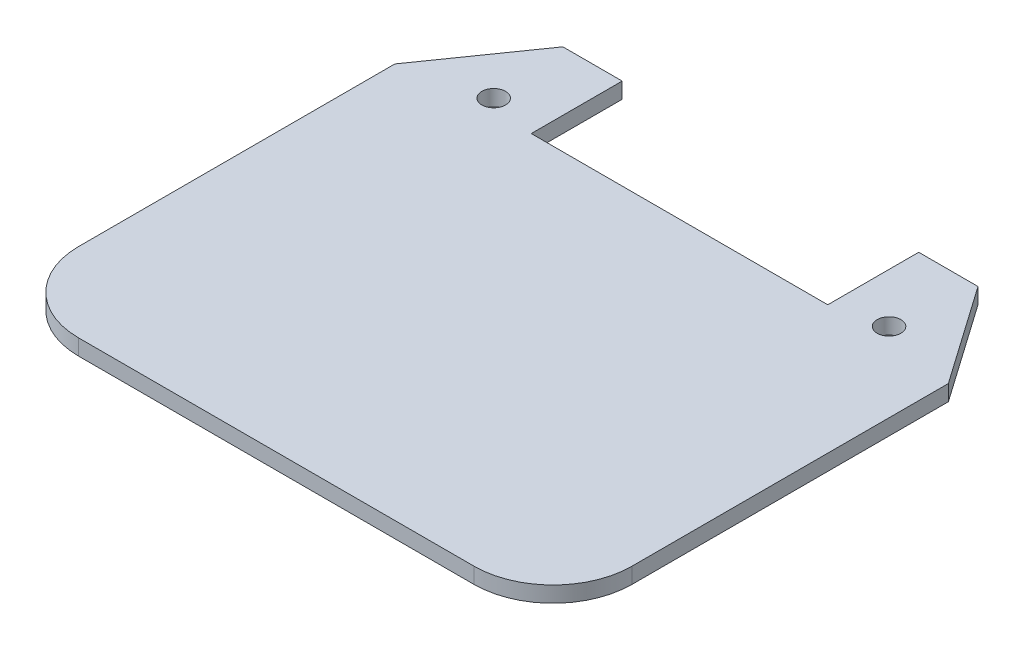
SolidWorks part; units mm, degrees
ref_plane "前视基准面" through (0, 0, 0) normal (0, 0, 1) x (1, 0, 0)
ref_plane "上视基准面" through (0, 0, 0) normal (0, 1, 0) x (1, 0, 0)
ref_plane "右视基准面" through (0, 0, 0) normal (1, 0, 0) x (0, 0, -1)
other "Configuration Table"
sketch "草图1" plane through (0, 0, 0) normal (0, 1, 0) x (1, 0, 0)
  line L0 (7, 3.75) -> (5.2495, 6.25)
  line L1 (-7, -6.25) -> (7, -6.25)
  line L2 (-7, -6.25) -> (-7, 6.25) construction
  line L3 (-7, 6.25) -> (7, 6.25) construction
  line L4 (7, -6.25) -> (7, 6.25) construction
  line L5 (-7, -6.25) -> (7, 6.25) construction
  line L6 (-7, 6.25) -> (7, -6.25) construction
  line L7 (5.2495, 6.25) -> (-5.2495, 6.25)
  line L8 (-5.2495, 6.25) -> (-7, 3.75)
  line L9 (-7, 3.75) -> (-7, -6.25)
  line L10 (7, 3.75) -> (7, -6.25)
  point P0 (0, 0)
  point P8 (0, 6.25)
  dimension "D1" = 14
  dimension "D2" = 12.5
  dimension "D3" = 10
  dimension "D4" = 125
  dimension "D5" = 125
extrude "凸台-拉伸1" add sketch "草图1" along normal blind 0.4
sketch "草图2" plane through (0, 0.4, 0) normal (0, 1, 0) x (1, 0, 0)
  line L1 (7, -6.25) -> (7, 3.75) construction
  line L6 (-7, -6.25) -> (7, -6.25) construction
  line L7 (-7, 3.75) -> (-7, -6.25) construction
  line L13 (5.2495, 6.25) -> (-5.2495, 6.25) construction
  line L17 (3.75, 6.25) -> (-3.75, 6.25)
  line L18 (3.75, 6.25) -> (3.75, 3.95)
  line L19 (3.75, 3.95) -> (-3.75, 3.95)
  line L20 (-3.75, 6.25) -> (-3.75, 3.95)
  circle A0 centre (-5, 4.25) radius 0.3
  circle A1 centre (5, 4.25) radius 0.3
  point P6 (0, 0)
  point P7 (0, 3.95)
  dimension "D3" = 0.6
  dimension "D4" = 0.6
  dimension "D1" = 7.5
  dimension "D2" = 10.2
  dimension "D5" = 2
  dimension "D6" = 2
  dimension "D7" = 2
extrude "切除-拉伸1" cut sketch "草图2" against normal blind 10
fillet "圆角1" radius 2 2 edges at (-7, 0.2, 6.25) (7, 0.2, 6.25)
